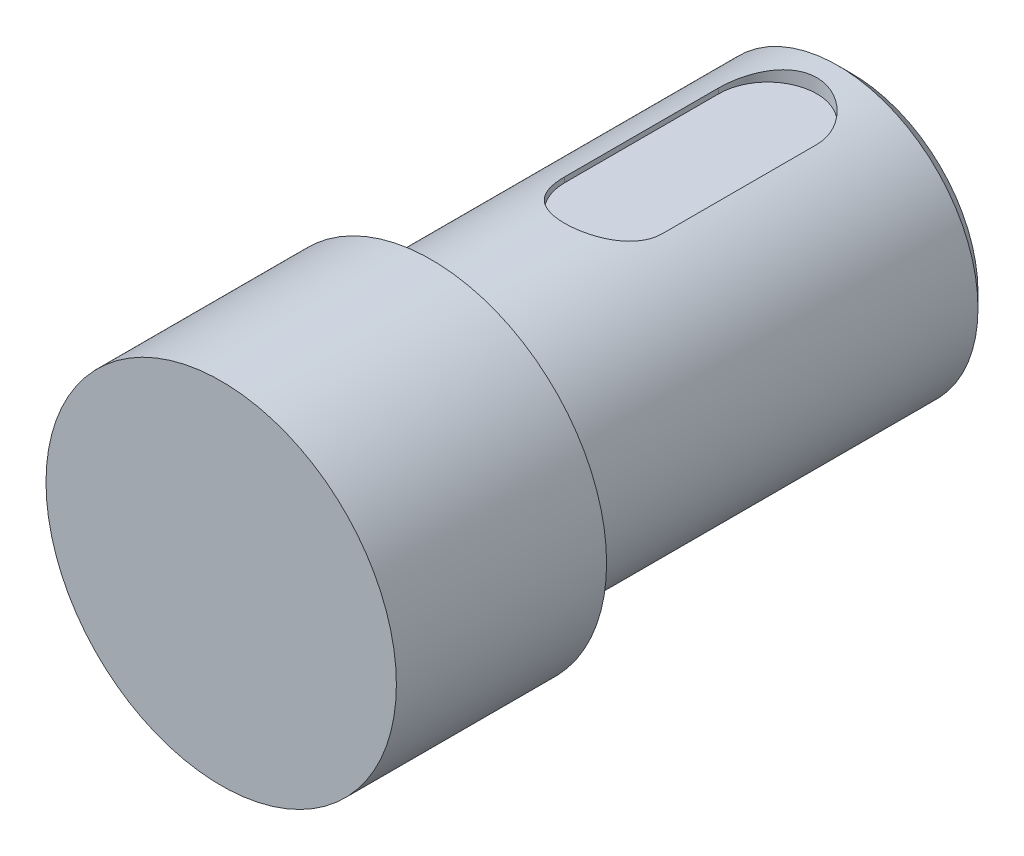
SolidWorks part; units mm, degrees
ref_plane "前视基准面" through (0, 0, 0) normal (0, 0, 1) x (1, 0, 0)
ref_plane "上视基准面" through (0, 0, 0) normal (0, 1, 0) x (1, 0, 0)
ref_plane "右视基准面" through (0, 0, 0) normal (1, 0, 0) x (0, 0, -1)
sketch "Sketch1" plane through (0, 0, 0) normal (0, 0, 1) x (1, 0, 0)
  circle A0 centre (0, 0) radius 20
extrude "Extrude1" add sketch "Sketch1" along normal blind 60
sketch "Sketch2" plane through (0, 0, 60) normal (0, 0, 1) x (1, 0, 0)
  circle A0 centre (0, 0) radius 25
extrude "Extrude2" add sketch "Sketch2" along normal blind 30
ref_plane "基准面1" through (0, 20, 0) normal (0, 1, 0) x (-1, 0, 0)
sketch "草图1" plane through (0, 20, 0) normal (0, 1, 0) x (-1, 0, 0)
  line L2 (-7, 34) -> (-7, 12)
  line L4 (7, 34) -> (7, 12)
  arc A0 (-7, 34) -> (7, 34) centre (0, 34) cw
  arc A1 (-7, 12) -> (7, 12) centre (0, 12) ccw
  dimension "D1" = 14
  dimension "D2" = 22
extrude "切除-拉伸1" cut sketch "草图1" against normal blind 2
chamfer "倒角1" distance 2 angle 45 1 edges at (20, 0, 0)
